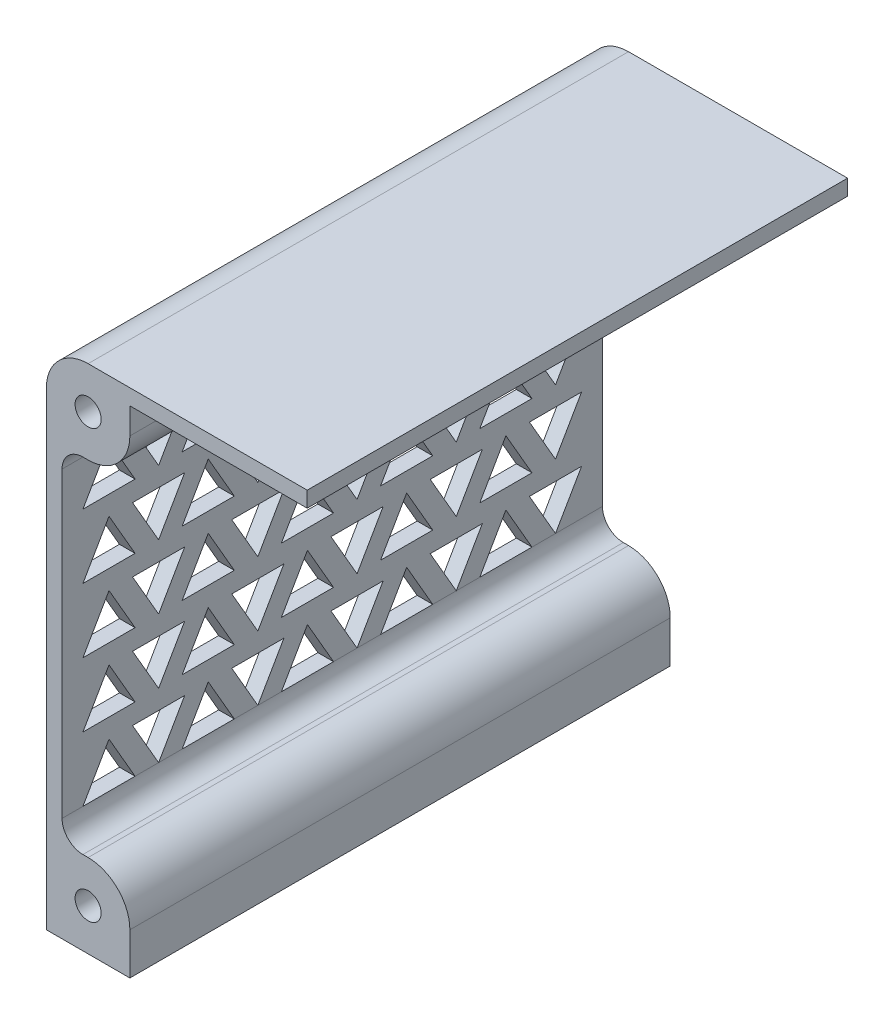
SolidWorks part; units mm, degrees
ref_plane "Front Plane" through (0, 0, 0) normal (0, 0, 1) x (1, 0, 0)
ref_plane "Top Plane" through (0, 0, 0) normal (0, 1, 0) x (1, 0, 0)
ref_plane "Right Plane" through (0, 0, 0) normal (1, 0, 0) x (0, 0, -1)
sketch "Sketch1" plane through (0, 0, 0) normal (0, 0, 1) x (1, 0, 0)
  line L0 (0, 0) -> (0, 49)
  line L1 (0, 49) -> (25, 49)
  line L6 (4, 41) -> (1.5, 41)
  line L7 (1.5, 41) -> (1.5, 8)
  line L8 (8, 45) -> (8, 47.5)
  line L10 (8, 4) -> (8, 0)
  line L12 (4, 8) -> (1.5, 8)
  line L13 (0, 0) -> (8, 0)
  line L14 (8, 47.5) -> (25, 47.5)
  line L15 (25, 47.5) -> (25, 49)
  circle A1 centre (4, 45) radius 1.25
  arc A2 (8, 45) -> (4, 41) centre (4, 45) cw
  circle A3 centre (4, 4) radius 1.25
  arc A4 (4, 8) -> (8, 4) centre (4, 4) cw
  dimension "D3" = 4
  dimension "D4" = 49
  dimension "D6" = 2.5
  dimension "D7" = 4
  dimension "D8" = 4
  dimension "D9" = 4
  dimension "D1" = 1.5
  dimension "D2" = 1.5
  dimension "D5" = 25
extrude "Boss-Extrude1" add sketch "Sketch1" along normal blind 51.8
fillet "Fillet1" radius 2 2 edges at (1.5, 8, 25.9) (1.5, 41, 25.9)
sketch "Sketch2" plane through (1.5, 0, 0) normal (1, 0, 0) x (0, 0, -1)
  line L0 (-47.3, 39) -> (-49.8, 34.6699)
  line L1 (-49.8, 34.6699) -> (-44.8, 34.6699)
  line L2 (-44.8, 34.6699) -> (-47.3, 39)
  line L3 (-51.8, 39) -> (0, 39) construction
  line L4 (-51.8, 10) -> (-51.8, 39) construction
  line L5 (0, 10) -> (0, 39) construction
  line L6 (-51.8, 34.6699) -> (0, 34.6699) construction
  line L8 (-42.5444, 34.6699) -> (-45.0444, 39)
  line L9 (-45.0444, 39) -> (-40.0444, 39)
  line L10 (-40.0444, 39) -> (-42.5444, 34.6699)
  line L11 (-37.7889, 39) -> (-40.2889, 34.6699)
  line L12 (-40.2889, 34.6699) -> (-35.2889, 34.6699)
  line L13 (-35.2889, 34.6699) -> (-37.7889, 39)
  line L14 (-33.0333, 34.6699) -> (-35.5333, 39)
  line L15 (-35.5333, 39) -> (-30.5333, 39)
  line L16 (-30.5333, 39) -> (-33.0333, 34.6699)
  line L17 (-28.2778, 39) -> (-30.7778, 34.6699)
  line L18 (-30.7778, 34.6699) -> (-25.7778, 34.6699)
  line L19 (-25.7778, 34.6699) -> (-28.2778, 39)
  line L20 (-23.5222, 34.6699) -> (-26.0222, 39)
  line L21 (-26.0222, 39) -> (-21.0222, 39)
  line L22 (-21.0222, 39) -> (-23.5222, 34.6699)
  line L23 (-18.7667, 39) -> (-21.2667, 34.6699)
  line L24 (-21.2667, 34.6699) -> (-16.2667, 34.6699)
  line L25 (-16.2667, 34.6699) -> (-18.7667, 39)
  line L26 (-14.0111, 34.6699) -> (-16.5111, 39)
  line L27 (-16.5111, 39) -> (-11.5111, 39)
  line L28 (-11.5111, 39) -> (-14.0111, 34.6699)
  line L29 (-9.2556, 39) -> (-11.7556, 34.6699)
  line L30 (-11.7556, 34.6699) -> (-6.7556, 34.6699)
  line L31 (-6.7556, 34.6699) -> (-9.2556, 39)
  line L32 (-4.5, 34.6699) -> (-7, 39)
  line L33 (-7, 39) -> (-2, 39)
  line L34 (-2, 39) -> (-4.5, 34.6699)
  line L35 (-46.05, 36.8349) -> (-43.7944, 36.8349) construction
  line L36 (-43.7944, 36.8349) -> (-41.2944, 36.8349) construction
  line L37 (-41.2944, 36.8349) -> (-39.0389, 36.8349) construction
  line L38 (-47.3, 32.8325) -> (-49.8, 28.5024)
  line L39 (-49.8, 28.5024) -> (-44.8, 28.5024)
  line L40 (-44.8, 28.5024) -> (-47.3, 32.8325)
  line L41 (-42.5444, 28.5024) -> (-45.0444, 32.8325)
  line L42 (-45.0444, 32.8325) -> (-40.0444, 32.8325)
  line L43 (-40.0444, 32.8325) -> (-42.5444, 28.5024)
  line L44 (-37.7889, 32.8325) -> (-40.2889, 28.5024)
  line L45 (-40.2889, 28.5024) -> (-35.2889, 28.5024)
  line L46 (-35.2889, 28.5024) -> (-37.7889, 32.8325)
  line L47 (-33.0333, 28.5024) -> (-35.5333, 32.8325)
  line L48 (-35.5333, 32.8325) -> (-30.5333, 32.8325)
  line L49 (-30.5333, 32.8325) -> (-33.0333, 28.5024)
  line L50 (-28.2778, 32.8325) -> (-30.7778, 28.5024)
  line L51 (-30.7778, 28.5024) -> (-25.7778, 28.5024)
  line L52 (-25.7778, 28.5024) -> (-28.2778, 32.8325)
  line L53 (-23.5222, 28.5024) -> (-26.0222, 32.8325)
  line L54 (-26.0222, 32.8325) -> (-21.0222, 32.8325)
  line L55 (-21.0222, 32.8325) -> (-23.5222, 28.5024)
  line L56 (-18.7667, 32.8325) -> (-21.2667, 28.5024)
  line L57 (-21.2667, 28.5024) -> (-16.2667, 28.5024)
  line L58 (-16.2667, 28.5024) -> (-18.7667, 32.8325)
  line L59 (-14.0111, 28.5024) -> (-16.5111, 32.8325)
  line L60 (-16.5111, 32.8325) -> (-11.5111, 32.8325)
  line L61 (-11.5111, 32.8325) -> (-14.0111, 28.5024)
  line L62 (-9.2556, 32.8325) -> (-11.7556, 28.5024)
  line L63 (-11.7556, 28.5024) -> (-6.7556, 28.5024)
  line L64 (-6.7556, 28.5024) -> (-9.2556, 32.8325)
  line L65 (-4.5, 28.5024) -> (-7, 32.8325)
  line L66 (-7, 32.8325) -> (-2, 32.8325)
  line L67 (-2, 32.8325) -> (-4.5, 28.5024)
  line L68 (-51.8, 32.8325) -> (0, 32.8325) construction
  line L69 (-51.8, 28.5024) -> (0, 28.5024) construction
  line L70 (-46.05, 30.6675) -> (-43.7944, 30.6675) construction
  line L71 (-43.7944, 30.6675) -> (-41.2944, 30.6675) construction
  line L72 (-41.2944, 30.6675) -> (-39.0389, 30.6675) construction
  line L73 (-47.3, 26.6651) -> (-49.8, 22.3349)
  line L74 (-49.8, 22.3349) -> (-44.8, 22.3349)
  line L75 (-44.8, 22.3349) -> (-47.3, 26.6651)
  line L76 (-42.5444, 22.3349) -> (-45.0444, 26.6651)
  line L77 (-45.0444, 26.6651) -> (-40.0444, 26.6651)
  line L78 (-40.0444, 26.6651) -> (-42.5444, 22.3349)
  line L79 (-37.7889, 26.6651) -> (-40.2889, 22.3349)
  line L80 (-40.2889, 22.3349) -> (-35.2889, 22.3349)
  line L81 (-35.2889, 22.3349) -> (-37.7889, 26.6651)
  line L82 (-33.0333, 22.3349) -> (-35.5333, 26.6651)
  line L83 (-35.5333, 26.6651) -> (-30.5333, 26.6651)
  line L84 (-30.5333, 26.6651) -> (-33.0333, 22.3349)
  line L85 (-28.2778, 26.6651) -> (-30.7778, 22.3349)
  line L86 (-30.7778, 22.3349) -> (-25.7778, 22.3349)
  line L87 (-25.7778, 22.3349) -> (-28.2778, 26.6651)
  line L88 (-23.5222, 22.3349) -> (-26.0222, 26.6651)
  line L89 (-26.0222, 26.6651) -> (-21.0222, 26.6651)
  line L90 (-21.0222, 26.6651) -> (-23.5222, 22.3349)
  line L91 (-18.7667, 26.6651) -> (-21.2667, 22.3349)
  line L92 (-21.2667, 22.3349) -> (-16.2667, 22.3349)
  line L93 (-16.2667, 22.3349) -> (-18.7667, 26.6651)
  line L94 (-14.0111, 22.3349) -> (-16.5111, 26.6651)
  line L95 (-16.5111, 26.6651) -> (-11.5111, 26.6651)
  line L96 (-11.5111, 26.6651) -> (-14.0111, 22.3349)
  line L97 (-9.2556, 26.6651) -> (-11.7556, 22.3349)
  line L98 (-11.7556, 22.3349) -> (-6.7556, 22.3349)
  line L99 (-6.7556, 22.3349) -> (-9.2556, 26.6651)
  line L100 (-4.5, 22.3349) -> (-7, 26.6651)
  line L101 (-7, 26.6651) -> (-2, 26.6651)
  line L102 (-2, 26.6651) -> (-4.5, 22.3349)
  line L103 (-51.8, 26.6651) -> (0, 26.6651) construction
  line L104 (-51.8, 22.3349) -> (0, 22.3349) construction
  line L105 (-46.05, 24.5) -> (-43.7944, 24.5) construction
  line L106 (-43.7944, 24.5) -> (-41.2944, 24.5) construction
  line L107 (-41.2944, 24.5) -> (-39.0389, 24.5) construction
  line L108 (-47.3, 20.4976) -> (-49.8, 16.1675)
  line L109 (-49.8, 16.1675) -> (-44.8, 16.1675)
  line L110 (-44.8, 16.1675) -> (-47.3, 20.4976)
  line L111 (-42.5444, 16.1675) -> (-45.0444, 20.4976)
  line L112 (-45.0444, 20.4976) -> (-40.0444, 20.4976)
  line L113 (-40.0444, 20.4976) -> (-42.5444, 16.1675)
  line L114 (-37.7889, 20.4976) -> (-40.2889, 16.1675)
  line L115 (-40.2889, 16.1675) -> (-35.2889, 16.1675)
  line L116 (-35.2889, 16.1675) -> (-37.7889, 20.4976)
  line L117 (-33.0333, 16.1675) -> (-35.5333, 20.4976)
  line L118 (-35.5333, 20.4976) -> (-30.5333, 20.4976)
  line L119 (-30.5333, 20.4976) -> (-33.0333, 16.1675)
  line L120 (-28.2778, 20.4976) -> (-30.7778, 16.1675)
  line L121 (-30.7778, 16.1675) -> (-25.7778, 16.1675)
  line L122 (-25.7778, 16.1675) -> (-28.2778, 20.4976)
  line L123 (-23.5222, 16.1675) -> (-26.0222, 20.4976)
  line L124 (-26.0222, 20.4976) -> (-21.0222, 20.4976)
  line L125 (-21.0222, 20.4976) -> (-23.5222, 16.1675)
  line L126 (-18.7667, 20.4976) -> (-21.2667, 16.1675)
  line L127 (-21.2667, 16.1675) -> (-16.2667, 16.1675)
  line L128 (-16.2667, 16.1675) -> (-18.7667, 20.4976)
  line L129 (-14.0111, 16.1675) -> (-16.5111, 20.4976)
  line L130 (-16.5111, 20.4976) -> (-11.5111, 20.4976)
  line L131 (-11.5111, 20.4976) -> (-14.0111, 16.1675)
  line L132 (-9.2556, 20.4976) -> (-11.7556, 16.1675)
  line L133 (-11.7556, 16.1675) -> (-6.7556, 16.1675)
  line L134 (-6.7556, 16.1675) -> (-9.2556, 20.4976)
  line L135 (-4.5, 16.1675) -> (-7, 20.4976)
  line L136 (-7, 20.4976) -> (-2, 20.4976)
  line L137 (-2, 20.4976) -> (-4.5, 16.1675)
  line L138 (-51.8, 20.4976) -> (0, 20.4976) construction
  line L139 (-51.8, 16.1675) -> (0, 16.1675) construction
  line L140 (-46.05, 18.3325) -> (-43.7944, 18.3325) construction
  line L141 (-43.7944, 18.3325) -> (-41.2944, 18.3325) construction
  line L142 (-41.2944, 18.3325) -> (-39.0389, 18.3325) construction
  line L143 (-47.3, 14.3301) -> (-49.8, 10)
  line L144 (-49.8, 10) -> (-44.8, 10)
  line L145 (-44.8, 10) -> (-47.3, 14.3301)
  line L146 (-42.5444, 10) -> (-45.0444, 14.3301)
  line L147 (-45.0444, 14.3301) -> (-40.0444, 14.3301)
  line L148 (-40.0444, 14.3301) -> (-42.5444, 10)
  line L149 (-37.7889, 14.3301) -> (-40.2889, 10)
  line L150 (-40.2889, 10) -> (-35.2889, 10)
  line L151 (-35.2889, 10) -> (-37.7889, 14.3301)
  line L152 (-33.0333, 10) -> (-35.5333, 14.3301)
  line L153 (-35.5333, 14.3301) -> (-30.5333, 14.3301)
  line L154 (-30.5333, 14.3301) -> (-33.0333, 10)
  line L155 (-28.2778, 14.3301) -> (-30.7778, 10)
  line L156 (-30.7778, 10) -> (-25.7778, 10)
  line L157 (-25.7778, 10) -> (-28.2778, 14.3301)
  line L158 (-23.5222, 10) -> (-26.0222, 14.3301)
  line L159 (-26.0222, 14.3301) -> (-21.0222, 14.3301)
  line L160 (-21.0222, 14.3301) -> (-23.5222, 10)
  line L161 (-18.7667, 14.3301) -> (-21.2667, 10)
  line L162 (-21.2667, 10) -> (-16.2667, 10)
  line L163 (-16.2667, 10) -> (-18.7667, 14.3301)
  line L164 (-14.0111, 10) -> (-16.5111, 14.3301)
  line L165 (-16.5111, 14.3301) -> (-11.5111, 14.3301)
  line L166 (-11.5111, 14.3301) -> (-14.0111, 10)
  line L167 (-9.2556, 14.3301) -> (-11.7556, 10)
  line L168 (-11.7556, 10) -> (-6.7556, 10)
  line L169 (-6.7556, 10) -> (-9.2556, 14.3301)
  line L170 (-4.5, 10) -> (-7, 14.3301)
  line L171 (-7, 14.3301) -> (-2, 14.3301)
  line L172 (-2, 14.3301) -> (-4.5, 10)
  line L173 (-51.8, 14.3301) -> (0, 14.3301) construction
  line L174 (-51.8, 10) -> (0, 10) construction
  line L175 (-46.05, 12.1651) -> (-43.7944, 12.1651) construction
  line L176 (-43.7944, 12.1651) -> (-41.2944, 12.1651) construction
  line L177 (-41.2944, 12.1651) -> (-39.0389, 12.1651) construction
  line L178 (0, 39) -> (-51.8, 39) construction
  line L179 (-51.8, 10) -> (0, 10) construction
  dimension "D1" = 5
  dimension "D3" = 2
  dimension "D4" = 5
  dimension "D6" = 2
  dimension "D5" = 5
extrude "Cut-Extrude1" cut sketch "Sketch2" against normal through all
sketch "Sketch4" plane through (0, 0, 51.8) normal (0, 0, 1) x (1, 0, 0)
  circle A0 centre (4, 4) radius 1.25 construction
  circle A1 centre (4, 4) radius 1.25
extrude "Boss-Extrude2" add sketch "Sketch4" against normal offset from surface (21.8 mm away) 15 from offset 15
fillet "Fillet3" radius 4 1 edges at (0, 49, 25.9)
